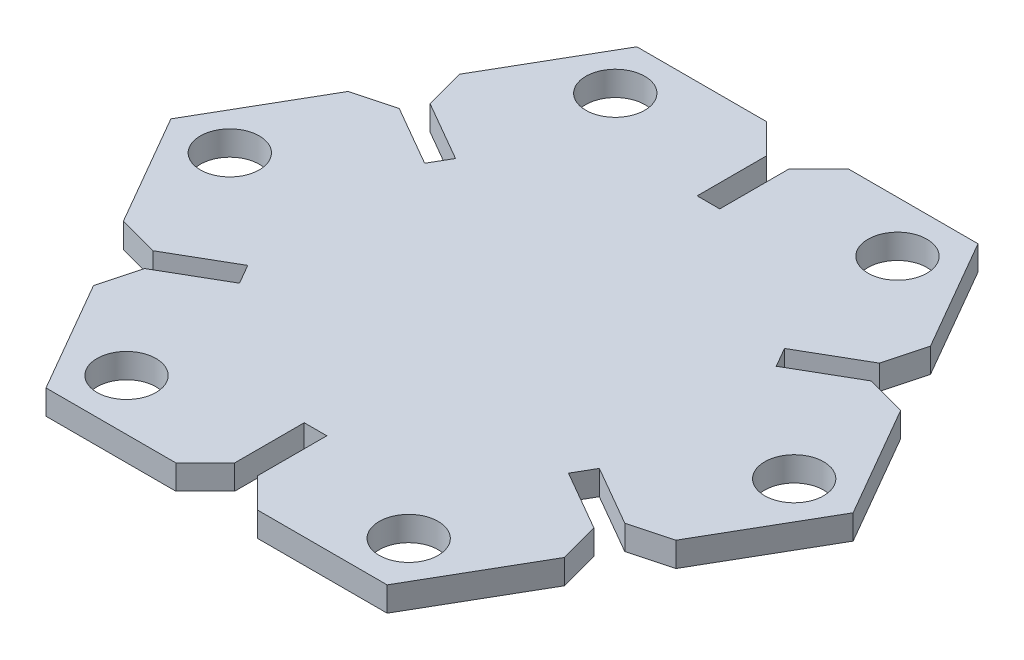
SolidWorks part; units mm, degrees
ref_plane "Alzado" through (0, 0, 0) normal (0, 0, 1) x (1, 0, 0)
ref_plane "Planta" through (0, 0, 0) normal (0, 1, 0) x (1, 0, 0)
ref_plane "Vista lateral" through (0, 0, 0) normal (1, 0, 0) x (0, 0, -1)
sketch "Croquis1" plane through (0, 0, 0) normal (0, 1, 0) x (1, 0, 0)
  line L0 (0, 0) -> (0, 30.075) construction
  line L1 (-17.3638, 30.075) -> (-23.9707, 18.6315)
  line L2 (-34.7276, 0) -> (-28.1207, -11.4435)
  line L3 (-17.3638, -30.075) -> (-4.15, -30.075)
  line L4 (17.3638, -30.075) -> (23.9707, -18.6315)
  line L5 (34.7276, 0) -> (28.1207, 11.4435)
  line L6 (17.3638, 30.075) -> (4.15, 30.075)
  line L7 (-4.15, 30.075) -> (-1.15, 27.075)
  line L8 (-1.15, 27.075) -> (-1.15, 20)
  line L9 (-1.15, 20) -> (1.15, 20)
  line L10 (1.15, 20) -> (1.15, 27.075)
  line L11 (1.15, 27.075) -> (4.15, 30.075)
  line L12 (-4.15, 30.075) -> (-17.3638, 30.075)
  line L13 (23.9707, 18.6315) -> (22.8726, 14.5334)
  line L14 (24.0226, 12.5416) -> (28.1207, 11.4435)
  line L15 (17.8955, 9.0041) -> (24.0226, 12.5416)
  line L16 (22.8726, 14.5334) -> (16.7455, 10.9959)
  line L17 (16.7455, 10.9959) -> (17.8955, 9.0041)
  line L18 (28.1207, -11.4435) -> (24.0226, -12.5416)
  line L19 (22.8726, -14.5334) -> (23.9707, -18.6315)
  line L20 (16.7455, -10.9959) -> (22.8726, -14.5334)
  line L21 (24.0226, -12.5416) -> (17.8955, -9.0041)
  line L22 (17.8955, -9.0041) -> (16.7455, -10.9959)
  line L23 (4.15, -30.075) -> (1.15, -27.075)
  line L24 (-1.15, -27.075) -> (-4.15, -30.075)
  line L25 (-1.15, -20) -> (-1.15, -27.075)
  line L26 (1.15, -27.075) -> (1.15, -20)
  line L27 (1.15, -20) -> (-1.15, -20)
  line L28 (-23.9707, -18.6315) -> (-22.8726, -14.5334)
  line L29 (-24.0226, -12.5416) -> (-28.1207, -11.4435)
  line L30 (-17.8955, -9.0041) -> (-24.0226, -12.5416)
  line L31 (-22.8726, -14.5334) -> (-16.7455, -10.9959)
  line L32 (-16.7455, -10.9959) -> (-17.8955, -9.0041)
  line L33 (-28.1207, 11.4435) -> (-24.0226, 12.5416)
  line L34 (-22.8726, 14.5334) -> (-23.9707, 18.6315)
  line L35 (-16.7455, 10.9959) -> (-22.8726, 14.5334)
  line L36 (-24.0226, 12.5416) -> (-17.8955, 9.0041)
  line L37 (-17.8955, 9.0041) -> (-16.7455, 10.9959)
  line L38 (-28.1207, 11.4435) -> (-34.7276, 0)
  line L39 (23.9707, 18.6315) -> (17.3638, 30.075)
  line L40 (28.1207, -11.4435) -> (34.7276, 0)
  line L41 (4.15, -30.075) -> (17.3638, -30.075)
  line L42 (-23.9707, -18.6315) -> (-17.3638, -30.075)
  line L43 (0, 0) -> (14.3638, 24.8788) construction
  line L44 (14.3638, 24.8788) -> (17.3638, 30.075) construction
  circle A0 centre (14.3638, 24.8788) radius 3
  circle A1 centre (28.7276, 0) radius 3
  circle A2 centre (14.3638, -24.8788) radius 3
  circle A3 centre (-14.3638, -24.8788) radius 3
  circle A4 centre (-28.7276, 0) radius 3
  circle A5 centre (-14.3638, 24.8788) radius 3
  point P12 (0, 20)
  point P51 (0, 0)
  point P62 (0, 0)
extrude "Saliente-Extruir1" add sketch "Croquis1" along normal mid plane 2.5 contours L2 L29 L30 L32 L31 L28 L42 L3 L24 L25 L27 L26 L23 L41 L4 L19 L20 L22 L21 L18 L40 L5 L14 L15 L17 L16 L13 L39 L6 L11 L10 L9 L8 L7 L12 L1 L34 L35 L37 L36 L33 L38
equation "\"Kerf\"= 0.15"
equation "\"Thickness\"= 2.5"
equation "\"Lenght\"= 60"
equation "\"D4@Croquis1\"= \"Lenght\" / 6 + \"Kerf\" / 2"
equation "\"D5@Croquis1\"=\"Lenght\"/20"
equation "\"D1@Croquis1\"=\"Lenght\"+\"Kerf\""
equation "\"D1@Saliente-Extruir1\"=\"Thickness\""
equation "\"D7@Croquis1\"=\"Lenght\" / 10"
equation "\"D_hole\"= 6"
equation "\"D8@Croquis1\"=\"D_hole\""
equation "\"D3@Croquis1\"=\"Thickness\" - \"Kerf\" - 0.05"
